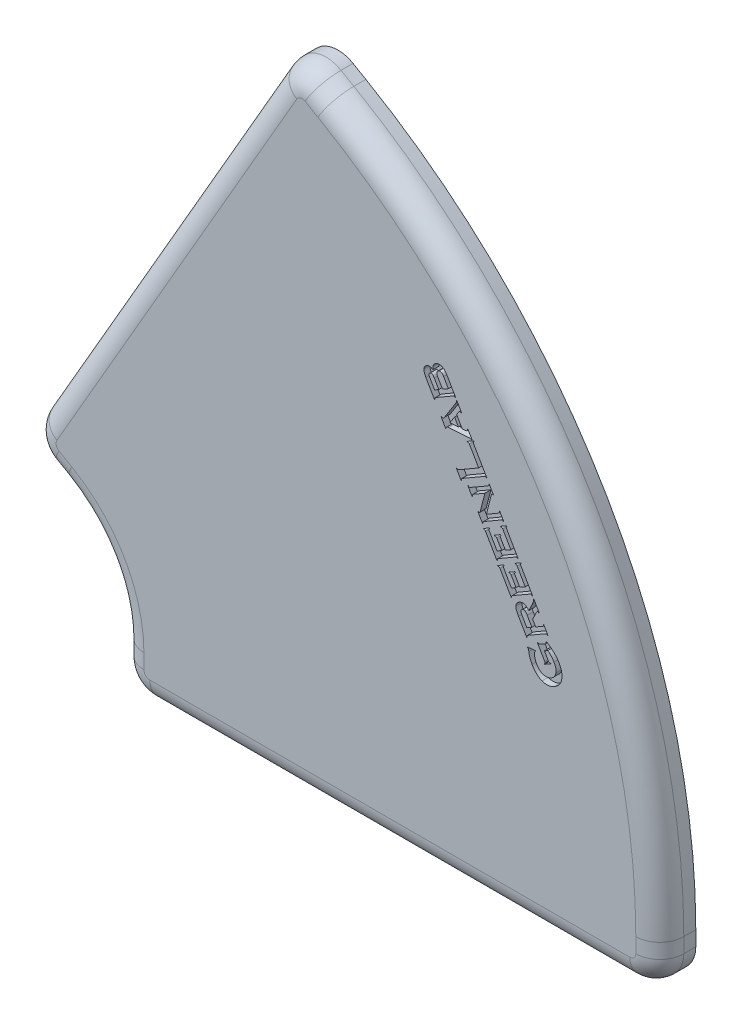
SolidWorks part; units mm, degrees
ref_plane "Front Plane" through (0, 0, 0) normal (0, 0, 1) x (1, 0, 0)
ref_plane "Top Plane" through (0, 0, 0) normal (0, 1, 0) x (1, 0, 0)
ref_plane "Right Plane" through (0, 0, 0) normal (1, 0, 0) x (0, 0, -1)
ref_plane "Plane1" through (0, 0, 3) normal (0, 0, 1) x (1, 0, 0)
sketch "Sketch1" plane through (0, 0, 3) normal (0, 0, 1) x (1, 0, 0)
  line L0 (22.5, -22.5) -> (22.5, 12.9903)
  line L1 (22.5, 12.9903) -> (-8.2356, 30.7356)
  line L2 (-8.2356, 30.7356) -> (-30.7356, -8.2356)
  line L3 (-30.7356, -8.2356) -> (-22.5, -12.9904)
  line L4 (-22.5, -12.9904) -> (-22.5, -22.5)
  line L5 (-22.5, -22.5) -> (22.5, -22.5)
  dimension "D1" = 30.7356
  dimension "D2" = 45
  dimension "D3" = 53.2356
  dimension "D4" = 9.5096
  dimension "D5" = 14.2644
  dimension "D6" = 35.4903
  dimension "D7" = 53.2356
extrude "Boss-Extrude1" add sketch "Sketch1" against normal blind 3
fillet "Fillet1" radius 2.5 4 edges at (-8.2356, 30.7356, 1.5) (-30.7356, -8.2356, 1.5) (22.5, -22.5, 1.5) (-22.5, -22.5, 1.5)
fillet "Fillet2" radius 10 1 edges at (-22.5, -12.9904, 1.5)
fillet "Fillet3" radius 55 1 edges at (22.5, 12.9903, 1.5)
fillet "Fillet4" radius 2 12 edges at (-23.8397, -13.7639, 3) (-28.0353, -9.7946, 3) (-22.5, -19.3819, 3) (-29.7353, -7.9676, 3) (-21.7678, -21.7678, 3) (-19.4856, 11.25, 3) (0, -22.5, 3) (-7.9676, 29.7353, 3) (21.7678, -21.7678, 3) (-5.5352, 29.1765, 3) (22.5, -19.3819, 3) (15.1314, 8.7361, 3)
sketch "Sketch2" plane through (0, 0, 3) normal (0, 0, 1) x (1, 0, 0)
  line L0 (20, -20.5) -> (-7.7535, 27.5705) construction
  line L1 (6.1232, 3.5353) -> (-43295.1471, -24996.4644) construction
  line L2 (-4.7522, 30.3721) -> (23.9269, -19.3016) construction
  text T0 "GreenLab" font "Copperplate Gothic Bold" height 2.5
  point P6 (6.1232, 3.5353)
  point P10 (9.5873, 5.5353)
  dimension "D1" = 4
extrude "Cut-Extrude1" cut sketch "Sketch2" against normal blind 0.5
